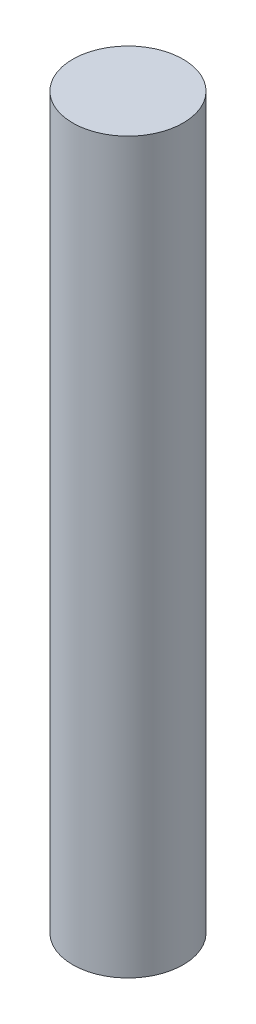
SolidWorks part; units mm, degrees
ref_plane "Ebene vorne" through (0, 0, 0) normal (0, 0, 1) x (1, 0, 0)
ref_plane "Ebene oben" through (0, 0, 0) normal (0, 1, 0) x (1, 0, 0)
ref_plane "Ebene rechts" through (0, 0, 0) normal (1, 0, 0) x (0, 0, -1)
sketch "Skizze1" plane through (0, 0, 0) normal (0, 1, 0) x (1, 0, 0)
  circle A0 centre (0, 0) radius 2.5
extrude "Aufsatz-Linear austragen1" add sketch "Skizze1" along normal blind 33
